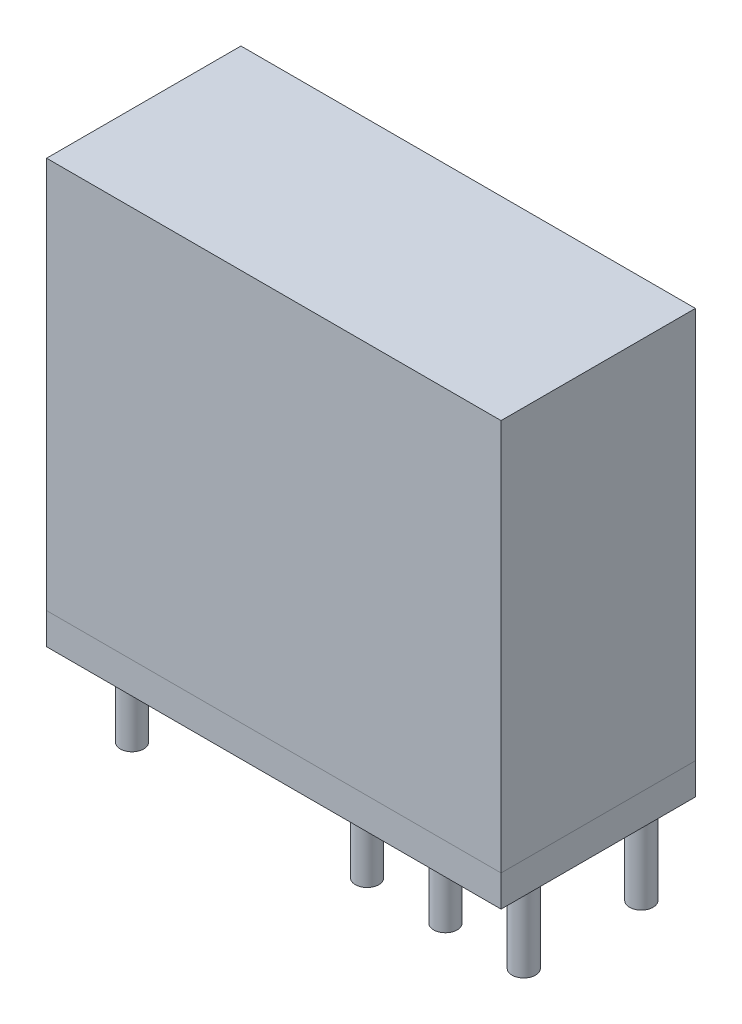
SolidWorks part; units mm, degrees
ref_plane "Plan de face" through (0, 0, 0) normal (0, 0, 1) x (1, 0, 0)
ref_plane "Plan de dessus" through (0, 0, 0) normal (0, 1, 0) x (1, 0, 0)
ref_plane "Plan de droite" through (0, 0, 0) normal (1, 0, 0) x (0, 0, -1)
sketch "Esquisse1" plane through (0, 0, 0) normal (0, 1, 0) x (1, 0, 0)
  line L0 (-3.0776, 0) -> (42.1659, 0) construction
  line L1 (0, -3.8809) -> (0, 22.8096) construction
  line L2 (29, -3.8809) -> (29, 22.8096) construction
  line L3 (-3.0776, 12.4) -> (42.1659, 12.4) construction
  line L4 (35.9025, 6.2) -> (29.8613, 6.2) construction
  line L6 (0, 12.4) -> (29, 12.4)
  line L7 (0, 12.4) -> (0, 0)
  line L8 (0, 0) -> (29, 0)
  line L9 (29, 12.4) -> (29, 0)
  dimension "D1" = 29
  dimension "D2" = 12.4
  dimension "D3" = 6.2
extrude "Boss.-Extru.1" add sketch "Esquisse1" along normal blind 2
sketch "Esquisse3" plane through (0, 2, 0) normal (0, 1, 0) x (1, 0, 0)
  line L0 (30.4435, 6.2) -> (9.9731, 6.2) construction
  line L1 (14.5, -2.9618) -> (14.5, 7.4385) construction
  line L3 (29.0002, -0.0002) -> (-0.0002, -0.0002)
  line L4 (29.0002, -0.0002) -> (29.0002, 12.4002)
  line L5 (29.0002, 12.4002) -> (-0.0002, 12.4002)
  line L6 (-0.0002, -0.0002) -> (-0.0002, 12.4002)
  line L7 (29.0002, -0.0002) -> (-0.0002, 12.4002) construction
  line L8 (29.0002, 12.4002) -> (-0.0002, -0.0002) construction
  point P4 (14.5, 6.2)
extrude "Boss.-Extru.3" add sketch "Esquisse3" along normal blind 25
sketch "Esquisse4" plane through (0, 0, 0) normal (0, -1, 0) x (1, 0, 0)
  line L0 (30.4797, -6.2) -> (-0.4615, -6.2) construction
  line L1 (28, 1.5777) -> (28, -9.2262) construction
  line L2 (23, 1.5777) -> (23, -9.2262) construction
  line L3 (18, 1.5777) -> (18, -9.2262) construction
  line L4 (3, 1.5777) -> (3, -9.2262) construction
  line L5 (29, 1.5777) -> (29, -13.0444) construction
  line L6 (30.4797, -2.45) -> (1.0601, -2.45) construction
  circle A0 centre (28, -2.45) radius 0.75
  circle A1 centre (23, -2.45) radius 0.75
  circle A2 centre (18, -2.45) radius 0.75
  circle A3 centre (3, -2.45) radius 0.75
  circle A4 centre (28, -9.95) radius 0.75
  circle A5 centre (23, -9.95) radius 0.75
  circle A6 centre (18, -9.95) radius 0.75
  circle A7 centre (3, -9.95) radius 0.75
  dimension "D1" = 5
  dimension "D2" = 5
  dimension "D3" = 6
  dimension "D4" = 3.75
  dimension "D5" = 20
extrude "Boss.-Extru.4" add sketch "Esquisse4" along normal blind 5
